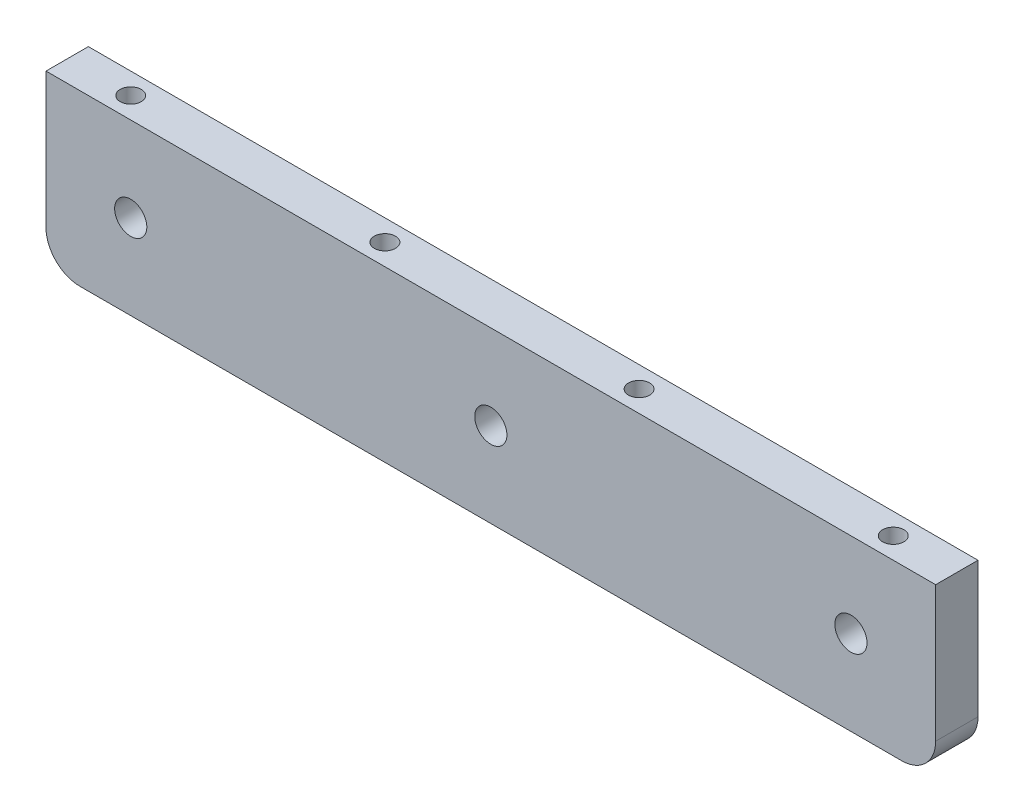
SolidWorks part; units mm, degrees
ref_plane "Front Plane" through (0, 0, 0) normal (0, 0, 1) x (1, 0, 0)
ref_plane "Top Plane" through (0, 0, 0) normal (0, 1, 0) x (1, 0, 0)
ref_plane "Right Plane" through (0, 0, 0) normal (1, 0, 0) x (0, 0, -1)
sketch "Sketch1" plane through (0, 0, 0) normal (0, 0, 1) x (1, 0, 0)
  line L0 (-1000, 0) -> (49000, 0) construction
  line L1 (0, -1000) -> (0, 49000) construction
  line L2 (133.35, 0) -> (-133.35, 0)
  line L3 (-133.35, 0) -> (-133.35, -40.64)
  line L4 (-123.19, -50.8) -> (123.19, -50.8)
  line L5 (133.35, 0) -> (133.35, -40.64)
  arc A0 (-133.35, -40.64) -> (-123.19, -50.8) centre (-123.19, -40.64) ccw
  arc A1 (133.35, -40.64) -> (123.19, -50.8) centre (123.19, -40.64) cw
  circle A2 centre (-107.95, -25.4) radius 4.826
  circle A3 centre (0, -25.4) radius 4.826
  circle A4 centre (107.95, -25.4) radius 4.826
  point P14 (0, -50.8)
  point P15 (0, 0)
  dimension "D1" = 10.16
  dimension "D4" = 9.652
  dimension "D2" = 266.7
  dimension "D3" = 50.8
  dimension "D5" = 25.4
  dimension "D6" = 25.4
extrude "Boss-Extrude1" add sketch "Sketch1" along normal mid plane 12.7
sketch "Sketch2" plane through (0, 0, 0) normal (0, 1, 0) x (1, 0, 0)
  line L0 (-1000, 0) -> (49000, 0) construction
  line L1 (0, -1000) -> (0, 49000) construction
  line L2 (133.35, -6.35) -> (133.35, 6.35) construction
  circle A0 centre (114.3, 0) radius 3.175
  circle A1 centre (38.1, 0) radius 3.175
  circle A2 centre (-38.1, 0) radius 3.175
  circle A3 centre (-114.3, 0) radius 3.175
  dimension "D1" = 6.35
  dimension "D2" = 19.05
  dimension "D3" = 76.2
extrude "Cut-Extrude1" cut sketch "Sketch2" against normal blind 19.05
